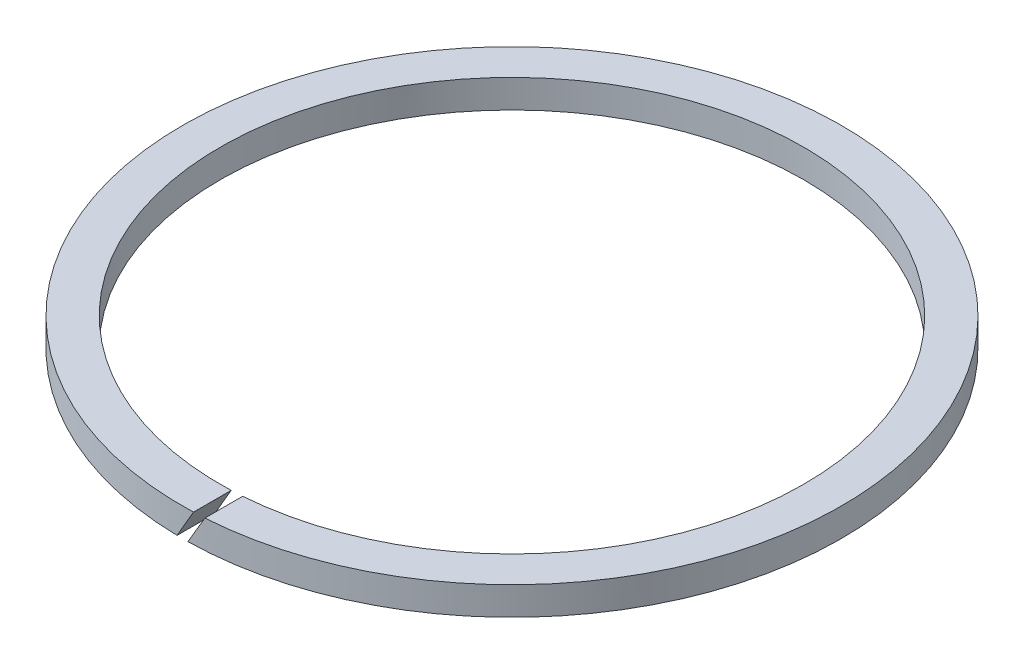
SolidWorks part; units mm, degrees
ref_plane "face" through (0, 0, 0) normal (0, 0, 1) x (1, 0, 0)
ref_plane "dessus" through (0, 0, 0) normal (0, 1, 0) x (1, 0, 0)
ref_plane "profil" through (0, 0, 0) normal (1, 0, 0) x (0, 0, -1)
sketch "Esquisse1" plane through (0, 0, 0) normal (0, 0, 1) x (1, 0, 0)
  line L0 (0, 50.034) -> (0, -35.6406) construction
  line L2 (15.5, 0) -> (17.5, 0)
  line L3 (15.5, 0) -> (15.5, 1.5)
  line L4 (15.5, 1.5) -> (17.5, 1.5)
  line L5 (17.5, 0) -> (17.5, 1.5)
  dimension "D1" = 1.5
  dimension "D2" = 2
  dimension "D3" = 17.5
revolve "Base-Révolution" add sketch "Esquisse1" angle 360 about L0
sketch "Esquisse2" plane through (0, 0, 0) normal (0, 0, 1) x (1, 0, 0)
  line L0 (0, 0) -> (6.2393, 10.8067) construction
  line L1 (-17.5, 0) -> (17.5, 0) construction
  line L2 (1.9443, 2.8677) -> (-0.3272, -1.0668)
  line L3 (1.367, 2.8677) -> (-0.9046, -1.0668)
  line L4 (1.367, 2.8677) -> (1.9443, 2.8677)
  line L5 (-0.9046, -1.0668) -> (-0.3272, -1.0668)
  dimension "D1" = 60
  dimension "D2" = 0.25
  dimension "D3" = 0.25
extrude "Enlèv. mat.-Extru.1" cut sketch "Esquisse2" along normal through all
